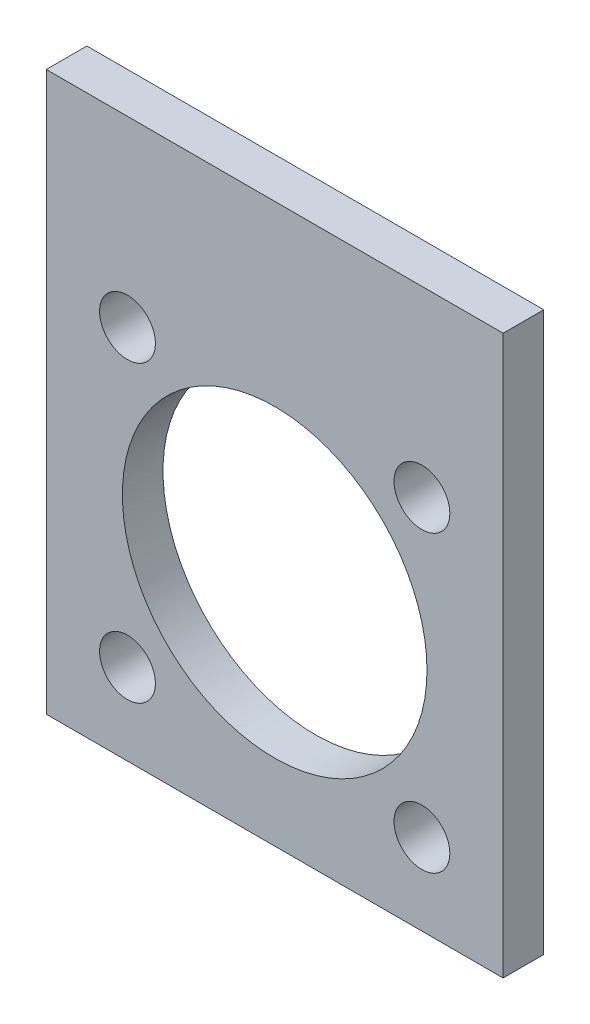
SolidWorks part; units mm, degrees
ref_plane "前视基准面" through (0, 0, 0) normal (0, 0, 1) x (1, 0, 0)
ref_plane "上视基准面" through (0, 0, 0) normal (0, 1, 0) x (1, 0, 0)
ref_plane "右视基准面" through (0, 0, 0) normal (1, 0, 0) x (0, 0, -1)
sketch "草图1" plane through (0, 0, 0) normal (0, 0, 1) x (1, 0, 0)
  line L1 (-45, 65) -> (45, 65)
  line L2 (-45, 65) -> (-45, -45)
  line L3 (-45, -45) -> (45, -45)
  line L4 (45, 65) -> (45, -45)
  circle A0 centre (0, 0) radius 30
  circle A1 centre (-29, 29) radius 5.5
  circle A2 centre (29, 29) radius 5.5
  circle A3 centre (-29, -29) radius 5.5
  circle A4 centre (29, -29) radius 5.5
  dimension "D1" = 45
  dimension "D5" = 60
  dimension "D6" = 16
  dimension "D7" = 58
  dimension "D8" = 58
  dimension "D9" = 29
  dimension "D10" = 11
  dimension "D11" = 11
  dimension "D12" = 11
  dimension "D13" = 11
  dimension "D2" = 110
  dimension "D3" = 90
  dimension "D4" = 45
extrude "拉伸1" add sketch "草图1" along normal blind 8
